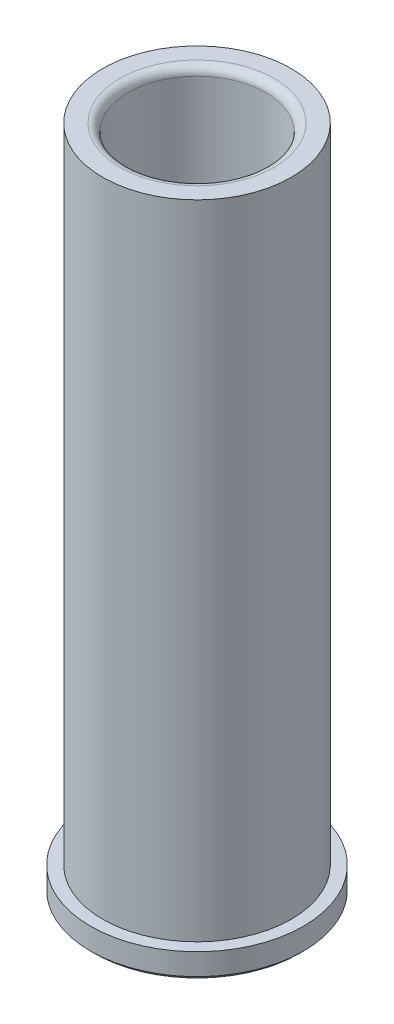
SolidWorks part; units mm, degrees
ref_plane "Front Plane" through (0, 0, 0) normal (0, 0, 1) x (1, 0, 0)
ref_plane "Top Plane" through (0, 0, 0) normal (0, 1, 0) x (1, 0, 0)
ref_plane "Right Plane" through (0, 0, 0) normal (1, 0, 0) x (0, 0, -1)
sketch "Sketch1" plane through (0, 0, 0) normal (0, 0, 1) x (1, 0, 0)
  line L0 (-18.9484, 0) -> (-19.7104, 0.762)
  line L1 (0, -1000) -> (0, 49000) construction
  line L2 (-12.7635, 123.825) -> (-12.7635, 0.762)
  line L3 (-13.5255, 0) -> (-18.9484, 0)
  line L4 (-19.7104, 0.762) -> (-19.7104, 4.7625)
  line L5 (-19.7104, 4.7625) -> (-17.4688, 4.7625)
  line L6 (-17.4688, 123.825) -> (-17.4688, 4.7625)
  line L7 (-17.4688, 123.825) -> (-12.7635, 123.825)
  line L8 (-13.5255, 0) -> (-12.7635, 0.762)
  dimension "OD" = 34.9377
  dimension "ID" = 25.527
  dimension "H" = 39.4208
  dimension "D2" = 45
  dimension "OVERALL LENGTH" = 123.825
  dimension "D4" = 0.762
  dimension "D5" = 135
  dimension "T" = 4.7625
revolve "Revolve1" add sketch "Sketch1" angle 360 about L1
fillet "Fillet1" radius 1.524 1 edges at (12.7635, 123.825, 0)
